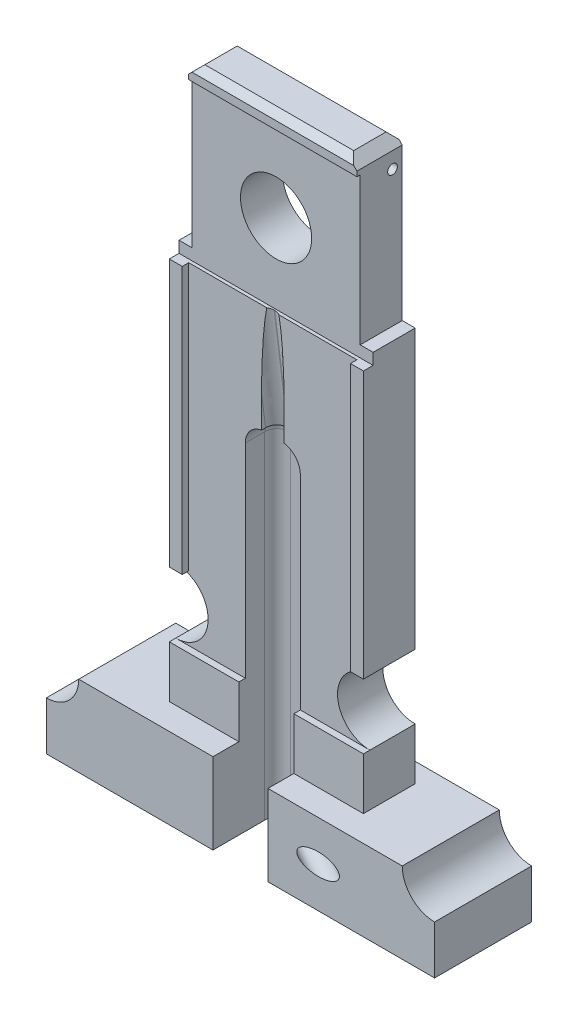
SolidWorks part; units mm, degrees
ref_plane "Ebene vorne" through (0, 0, 0) normal (0, 0, 1) x (1, 0, 0)
ref_plane "Ebene oben" through (0, 0, 0) normal (0, 1, 0) x (1, 0, 0)
ref_plane "Ebene rechts" through (0, 0, 0) normal (1, 0, 0) x (0, 0, -1)
sketch "Skizze1" plane through (0, 0, 0) normal (0, 0, 1) x (1, 0, 0)
  line L1 (-30, -6.25) -> (30, -6.25)
  line L2 (-30, -6.25) -> (-30, 6.25)
  line L3 (-30, 6.25) -> (30, 6.25)
  line L4 (30, -6.25) -> (30, 6.25)
  line L5 (-30, -6.25) -> (30, 6.25) construction
  line L6 (-30, 6.25) -> (30, -6.25) construction
  point P0 (0, 0)
  dimension "D1" = 12.5
  dimension "D2" = 60
extrude "Aufsatz-Linear austragen1" add sketch "Skizze1" against normal blind 15
sketch "Skizze2" plane through (0, 0, 0) normal (0, 0, 1) x (1, 0, 0)
  line L0 (30, 6.25) -> (-30, 6.25) construction
  circle A0 centre (30, 6.25) radius 5
  circle A1 centre (-30, 6.25) radius 5
  dimension "D1" = 10
  dimension "D2" = 10
extrude "Schnitt-Linear austragen1" cut sketch "Skizze2" against normal through all
sketch "Skizze3" plane through (0, 0, 0) normal (0, 0, 1) x (1, 0, 0)
  line L0 (0, 47.0391) -> (0, -27.7977) construction
  line L1 (25, 6.25) -> (-25, 6.25) construction
  line L2 (-15, 6.25) -> (15, 6.25)
  line L3 (-15, 6.25) -> (-15, 92.25)
  line L4 (-15, 92.25) -> (15, 92.25)
  line L5 (15, 6.25) -> (15, 92.25)
  line L6 (-15, 6.25) -> (15, 92.25) construction
  line L7 (-15, 92.25) -> (15, 6.25) construction
  point P3 (0, 49.25)
  dimension "D1" = 30
  dimension "D2" = 86
  dimension "D3" = 0
extrude "Aufsatz-Linear austragen2" add sketch "Skizze3" against normal through all
sketch "Skizze4" plane through (0, 0, 0) normal (0, 0, 1) x (1, 0, 0)
  line L0 (0, 96.1586) -> (0, -18.3498) construction
  line L1 (25, 6.25) -> (15, 6.25) construction
  line L2 (-44.5606, 6.25) -> (44.5606, 6.25)
  line L3 (-44.5606, 6.25) -> (-44.5606, 108.3153)
  line L4 (-44.5606, 108.3153) -> (44.5606, 108.3153)
  line L5 (44.5606, 6.25) -> (44.5606, 108.3153)
  line L6 (-44.5606, 6.25) -> (44.5606, 108.3153) construction
  line L7 (-44.5606, 108.3153) -> (44.5606, 6.25) construction
  point P3 (0, 57.2827)
  dimension "D1" = 0
extrude "Schnitt-Linear austragen2" cut sketch "Skizze4" against normal blind 4
sketch "Skizze5" plane through (0, 0, -15) normal (0, 0, -1) x (-1, 0, 0)
  line L0 (0, 95.323) -> (0, -12.5893) construction
  line L1 (15, 6.25) -> (25, 6.25) construction
  line L2 (-22.1689, 6.25) -> (22.1689, 6.25)
  line L3 (-22.1689, 6.25) -> (-22.1689, 93.2835)
  line L4 (-22.1689, 93.2835) -> (22.1689, 93.2835)
  line L5 (22.1689, 6.25) -> (22.1689, 93.2835)
  line L6 (-22.1689, 6.25) -> (22.1689, 93.2835) construction
  line L7 (-22.1689, 93.2835) -> (22.1689, 6.25) construction
  point P3 (0, 49.7668)
  dimension "D1" = 0
extrude "Schnitt-Linear austragen3" cut sketch "Skizze5" against normal blind 3
sketch "Skizze6" plane through (0, 0, -4) normal (0, 0, 1) x (1, 0, 0)
  line L0 (-15, 92.25) -> (-15, 6.25) construction
  line L1 (15, 6.25) -> (15, 92.25) construction
  line L2 (-30, -6.25) -> (30, -6.25) construction
  circle A0 centre (-15, 19.25) radius 5
  circle A1 centre (15, 19.25) radius 5
  dimension "D1" = 10
  dimension "D2" = 10
  dimension "D3" = 25.5
  dimension "D4" = 25.5
extrude "Schnitt-Linear austragen4" cut sketch "Skizze6" against normal through all
sketch "Skizze7" plane through (0, 0, -4) normal (0, 0, 1) x (1, 0, 0)
  line L0 (0, 95.9974) -> (0, -9.7717) construction
  line L2 (-13, 14.25) -> (13, 14.25)
  line L3 (-13, 14.25) -> (-13, 94.25)
  line L4 (-13, 94.25) -> (13, 94.25)
  line L5 (13, 14.25) -> (13, 94.25)
  line L6 (-13, 14.25) -> (13, 94.25) construction
  line L7 (-13, 94.25) -> (13, 14.25) construction
  line L8 (-30, -6.25) -> (30, -6.25) construction
  point P3 (0, 54.25)
  dimension "D1" = 26
  dimension "D2" = 80
  dimension "D3" = 20.5
extrude "Schnitt-Linear austragen5" cut sketch "Skizze7" against normal blind 1
sketch "Skizze9" plane through (0, 0, -4) normal (0, 0, 1) x (1, 0, 0)
  line L0 (-22.6508, 77.75) -> (28.4452, 77.75) construction
  line L1 (-30, -6.25) -> (30, -6.25) construction
  line L3 (-24.1564, 65.5) -> (24.1564, 65.5)
  line L4 (-24.1564, 65.5) -> (-24.1564, 90)
  line L5 (-24.1564, 90) -> (24.1564, 90)
  line L6 (24.1564, 65.5) -> (24.1564, 90)
  line L7 (-24.1564, 65.5) -> (24.1564, 90) construction
  line L8 (-24.1564, 90) -> (24.1564, 65.5) construction
  point P4 (0, 77.75)
  dimension "D1" = 84
  dimension "D2" = 24.5
extrude "Schnitt-Linear austragen7" cut sketch "Skizze9" against normal blind 1.5
sketch "Skizze10" plane through (0, 0, -5.5) normal (0, 0, 1) x (1, 0, 0)
  line L0 (-30, -6.25) -> (30, -6.25) construction
  circle A0 centre (0, 77.75) radius 5.5
  dimension "D1" = 11
  dimension "D2" = 84
extrude "Schnitt-Linear austragen8" cut sketch "Skizze10" against normal through all
sketch "Skizze11" plane through (-15, 0, 0) normal (-1, 0, 0) x (0, 0, 1)
  line L0 (-12, 92.25) -> (-4, 92.25) construction
  line L1 (-19.9396, 67.25) -> (2.8623, 67.25)
  line L2 (-19.9396, 67.25) -> (-19.9396, 93.6641)
  line L3 (-19.9396, 93.6641) -> (2.8623, 93.6641)
  line L4 (2.8623, 67.25) -> (2.8623, 93.6641)
  line L5 (-19.9396, 67.25) -> (2.8623, 93.6641) construction
  line L6 (-19.9396, 93.6641) -> (2.8623, 67.25) construction
  point P0 (-8.5387, 80.457)
  dimension "D1" = 25
extrude "Schnitt-Linear austragen9" cut sketch "Skizze11" against normal blind 2
sketch "Skizze12" plane through (15, 0, 0) normal (1, 0, 0) x (0, 0, -1)
  line L0 (12, 92.25) -> (4, 92.25) construction
  line L1 (-1.8691, 67.25) -> (17.9979, 67.25)
  line L2 (-1.8691, 67.25) -> (-1.8691, 95.4701)
  line L3 (-1.8691, 95.4701) -> (17.9979, 95.4701)
  line L4 (17.9979, 67.25) -> (17.9979, 95.4701)
  line L5 (-1.8691, 67.25) -> (17.9979, 95.4701) construction
  line L6 (-1.8691, 95.4701) -> (17.9979, 67.25) construction
  point P0 (8.0644, 81.3601)
  dimension "D1" = 25
extrude "Schnitt-Linear austragen10" cut sketch "Skizze12" against normal blind 2
sketch "Skizze14" plane through (0, 0, 0) normal (0, 0, 1) x (1, 0, 0)
  line L0 (0, -12.5729) -> (0, 95.9969) construction
  line L1 (-30, -6.25) -> (30, -6.25) construction
  line L2 (-4.25, -26.9125) -> (4.25, -26.9125)
  line L3 (-4.25, -26.9125) -> (-4.25, 45.75)
  line L4 (-1.25, 48.75) -> (1.25, 48.75)
  line L5 (4.25, -26.9125) -> (4.25, 45.75)
  line L6 (-4.25, -26.9125) -> (4.25, 48.75) construction
  line L7 (-4.25, 48.75) -> (4.25, -26.9125) construction
  arc A0 (-4.25, 45.75) -> (-1.25, 48.75) centre (-1.25, 45.75) cw
  arc A1 (1.25, 48.75) -> (4.25, 45.75) centre (1.25, 45.75) cw
  point P3 (0, 10.9187)
  dimension "D3" = 3
  dimension "D1" = 8.5
  dimension "D2" = 55
extrude "Schnitt-Linear austragen11" cut sketch "Skizze14" against normal blind 10
sketch "Skizze16" plane through (0, 0, -4) normal (0, 0, 1) x (1, 0, 0)
  line L0 (-17.2774, 14.25) -> (17.5425, 14.25)
  line L1 (17.5425, 14.25) -> (17.5425, 24.25)
  line L2 (17.5425, 24.25) -> (-17.2774, 24.25)
  line L3 (-17.2774, 24.25) -> (-17.2774, 14.25)
extrude "Schnitt-Linear austragen12" cut sketch "Skizze16" against normal blind 1
sketch "Skizze18" plane through (0, 0, 0) normal (1, 0, 0) x (0, 0, -1)
  line L0 (-3.7881, 47.75) -> (18.7881, 47.75) construction
  line L1 (15, -6.25) -> (0, -6.25) construction
  line L2 (7.5, 47.75) -> (4.9159, 68.625)
  line L3 (4, 24.25) -> (4, 65.5) construction
  dimension "D1" = 54
  dimension "D2" = 3.5
ref_plane "Ebene1" through (0, 47.75, 0) normal (0, 1, 0) x (1, 0, 0)
sketch "Skizze19" plane through (0, 47.75, 0) normal (0, 1, 0) x (1, 0, 0)
  line L0 (-1.75, 2.9142) -> (1.75, 2.9142)
  line L1 (1.75, 2.9142) -> (1.75, 5.7462)
  line L2 (0.05, 7.4462) -> (-0.05, 7.4462)
  line L3 (-1.75, 5.7462) -> (-1.75, 2.9142)
  line L4 (0, -3.7881) -> (0, 18.7881) construction
  arc A0 (-0.05, 7.4462) -> (-1.75, 5.7462) centre (-0.05, 5.7462) ccw
  arc A1 (0.05, 7.4462) -> (1.75, 5.7462) centre (0.05, 5.7462) cw
  dimension "D3" = 1.7
  dimension "D1" = 3.5
  dimension "D2" = 1.75
sweep "Schnitt-Austragung2" cut profiles "Skizze19" path "Skizze18"
fillet "Verrundung4" radius 2 5 edges at (4.25, 19.75, -10) (3.3713, 47.8713, -10) (0, 48.75, -10) (-3.3713, 47.8713, -10) (-4.25, 19.75, -10)
sketch "Skizze21" plane through (0, 0, 0) normal (0, 0, 1) x (1, 0, 0)
  line L0 (12, 6.25) -> (12, -6.25)
  line L1 (25, 6.25) -> (4.25, 6.25) construction
  line L2 (4.25, -6.25) -> (30, -6.25) construction
  dimension "D1" = 12
ref_plane "Ebene2" through (9, 0, 5.1962) normal (-0.866, 0, -0.5) x (-0.5, 0, 0.866)
sketch "Skizze22" plane through (9, 0, 5.1962) normal (-0.866, 0, -0.5) x (-0.5, 0, 0.866)
  line L0 (-6, 6.25) -> (-6, -6.25) construction
  circle A0 centre (-6, 0) radius 1.65
  dimension "D1" = 3.3
extrude "Schnitt-Linear austragen14" cut sketch "Skizze22" against normal mid plane 25
chamfer "Fase1" distance 1.5 angle 45 2 edges at (13, 92.25, -8.5) (-13, 92.25, -8.5)
chamfer "Fase2" distance 1 angle 45 2 edges at (0, 92.25, -12) (0, 92.25, -5)
sketch "Skizze23" plane through (-13, 0, 0) normal (-1, 0, 0) x (0, 0, 1)
  line L0 (-12, 67.25) -> (-12, 90.75) construction
  line L1 (-11, 92.25) -> (-6, 92.25) construction
  circle A0 centre (-10.5, 88.25) radius 0.75
  dimension "D1" = 1.5
  dimension "D2" = 1.5
  dimension "D3" = 4
extrude "Schnitt-Linear austragen15" cut sketch "Skizze23" against normal blind 5
sketch "Skizze24" plane through (13, 0, 0) normal (1, 0, 0) x (0, 0, -1)
  line L0 (12, 90.75) -> (12, 67.25) construction
  line L1 (6, 92.25) -> (11, 92.25) construction
  circle A0 centre (10.5, 88.25) radius 0.75
  dimension "D1" = 1.5
  dimension "D2" = 1.5
  dimension "D3" = 4
extrude "Schnitt-Linear austragen16" cut sketch "Skizze24" against normal blind 5
